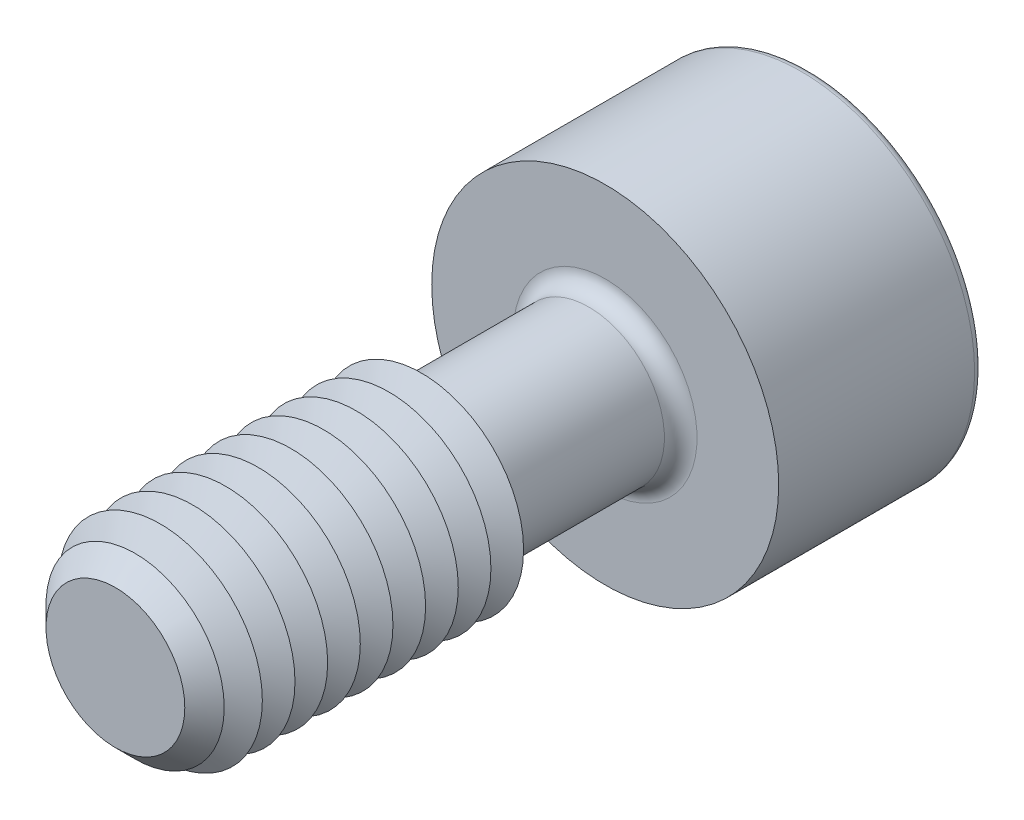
SolidWorks part; units mm, degrees
ref_plane "Front Plane" through (0, 0, 0) normal (0, 0, 1) x (1, 0, 0)
ref_plane "Top Plane" through (0, 0, 0) normal (0, 1, 0) x (1, 0, 0)
ref_plane "Right Plane" through (0, 0, 0) normal (1, 0, 0) x (0, 0, -1)
sketch "Sketch1" plane through (0, 0, 0) normal (0, 0, 1) x (1, 0, 0)
  circle A0 centre (0, 0) radius 1.85
  dimension "D1" = 3.7
extrude "Extrude1" add sketch "Sketch1" along normal mid plane 12
sketch "Sketch2" plane through (0, 0, 0) normal (1, 0, 0) x (0, 0, -1)
  line L0 (-6, 0) -> (-6, 2.5)
  line L1 (-6, 1.85) -> (-6, -1.85) construction
  line L2 (-6, 2.5) -> (1.5, 2.5)
  line L3 (1.5, 2.5) -> (1.8753, 1.85)
  line L4 (6, 1.85) -> (-6, 1.85) construction
  line L5 (1.8753, 1.85) -> (1.8753, 0)
  line L6 (1.8753, 0) -> (-6, 0)
  dimension "D1" = 2.5
  dimension "D2" = 120
  dimension "D3" = 7.5
revolve "Revolve1" add sketch "Sketch2" angle 360 about L6
chamfer "Chamfer1" distance 0.8 angle 45 1 edges at (0, 2.5, 6)
sketch "Sketch3" plane through (0, 0, -6) normal (0, 0, -1) x (-1, 0, 0)
  circle A0 centre (0, 0) radius 4.25
  dimension "D1" = 8.5
extrude "Extrude2" add sketch "Sketch3" along normal blind 5
sketch "Sketch4" plane through (-13.7, 0, -11) normal (0, 0, 1) x (1, 0, 0)
  line L2 (12.5453, -2) -> (14.8547, -2)
  line L3 (14.8547, -2) -> (16.0094, 0)
  line L4 (16.0094, 0) -> (14.8547, 2)
  line L6 (14.8547, 2) -> (12.5453, 2)
  line L7 (12.5453, 2) -> (11.3906, 0)
  line L8 (11.3906, 0) -> (12.5453, -2)
  circle A0 centre (13.7, 0) radius 2 construction
  dimension "D1" = 4
extrude "Extrude3" cut sketch "Sketch4" along normal blind 4
fillet "Fillet1" radius 0.4 1 edges at (-1.85, 0, -6)
fillet "Fillet2" radius 0.2 1 edges at (-4.25, 0, -11)
sketch "Sketch5" plane through (0, 0, 0) normal (1, 0, 0) x (0, 0, -1)
  line L0 (7, 0) -> (7, -2)
  line L1 (7, -2) -> (5.8453, 0)
  line L2 (5.8453, 0) -> (7, 0)
  dimension "D1" = 30
revolve "Cut-Revolve1" cut sketch "Sketch5" angle 360 about L2
sketch "Sketch6" plane through (0, 0, 0) normal (1, 0, 0) x (0, 0, -1)
  line L0 (1.332, 0) -> (-13.289, 0) construction
sketch "Sketch7" plane through (0, 0, 0) normal (1, 0, 0) x (0, 0, -1)
  line L0 (1.5, 2.5) -> (1.1, 1.8072)
  line L1 (1.1, 1.8072) -> (0.7, 2.5)
  line L2 (1.5, 2.5) -> (-5.2, 2.5) construction
  line L3 (0.7, 2.5) -> (1.5, 2.5)
  dimension "D1" = 0.8
revolve "Cut-Revolve2" cut sketch "Sketch7" angle 360 about L0
pattern_linear "LPattern1" count 9 spacing 0.8 along (0, 0, 1) of "Cut-Revolve2"
